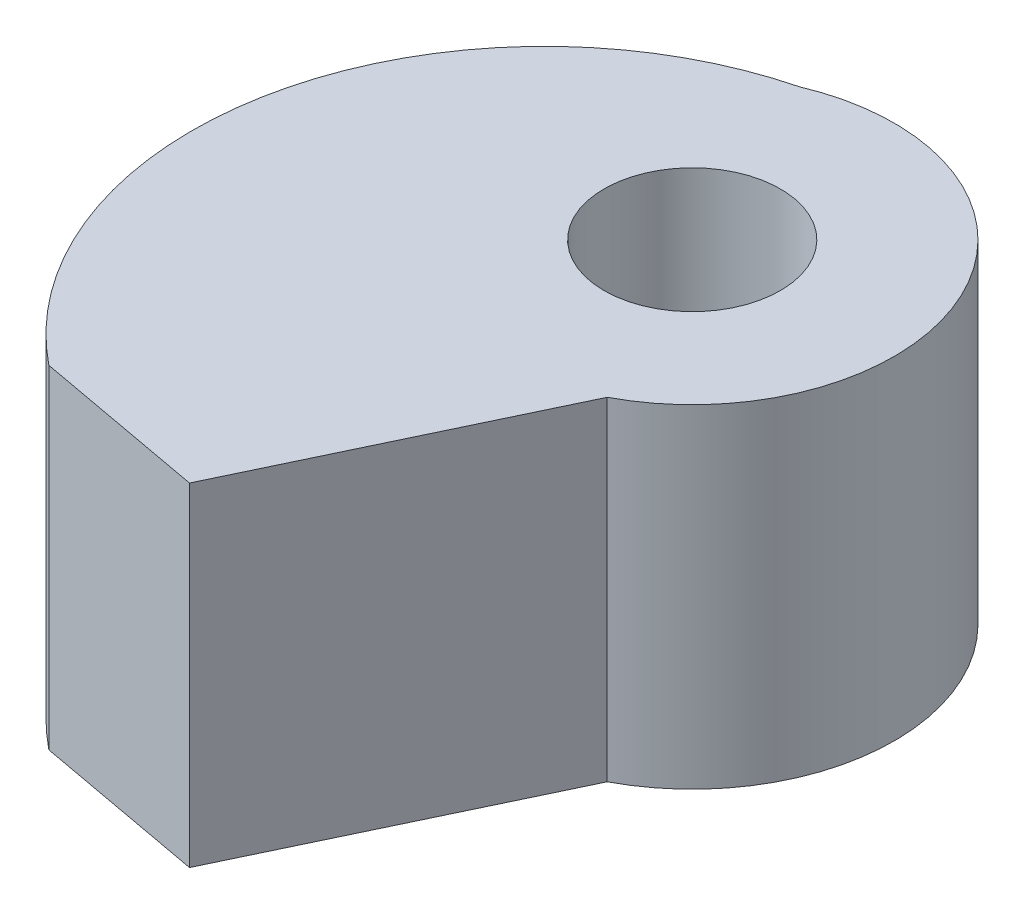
SolidWorks part; units mm, degrees
ref_plane "Plan de face" through (0, 0, 0) normal (0, 0, 1) x (1, 0, 0)
ref_plane "Plan de dessus" through (0, 0, 0) normal (0, 1, 0) x (1, 0, 0)
ref_plane "Plan de droite" through (0, 0, 0) normal (1, 0, 0) x (0, 0, -1)
sketch "Esquisse1" plane through (0, 0, 0) normal (0, 1, 0) x (1, 0, 0)
  circle A0 centre (0, 0) radius 2.45
  circle A1 centre (0, 0) radius 5.158
  dimension "D1" = 4.9
extrude "Boss.-Extru.1" add sketch "Esquisse1" along normal blind 2.5
sketch "Esquisse2" plane through (0, 2.5, 0) normal (0, 1, 0) x (1, 0, 0)
  circle A0 centre (0, 0) radius 5.158
  circle A1 centre (0, 0) radius 1
  dimension "D1" = 2
extrude "Boss.-Extru.2" add sketch "Esquisse2" along normal blind 6
sketch "Esquisse3" plane through (0, 8.5, 0) normal (0, 1, 0) x (1, 0, 0)
  circle A0 centre (0, 0) radius 2.25
  dimension "D1" = 4.5
extrude "Enlèv. mat.-Extru.1" cut sketch "Esquisse3" against normal blind 5.5
sketch "Esquisse4" plane through (0, 8.5, 0) normal (0, 1, 0) x (1, 0, 0)
  line L5 (-1.0378, -11.7939) -> (2.3976, -4.5669)
  line L6 (2.3976, -4.5669) -> (-3.1636, -1.8909)
  line L7 (-3.1636, -1.8909) -> (-2.8226, 2.5391)
  line L8 (-2.8226, 2.5391) -> (1.5082, 4.9326)
  line L9 (-5.4353, -10.9867) -> (-1.0378, -11.7939)
  arc A2 (1.5082, 4.9326) -> (-5.4353, -10.9867) centre (0.2038, -3.9724) ccw
  circle A4 centre (0, 0) radius 5.158 construction
  dimension "D2" = 9
extrude "Boss.-Extru.3" add sketch "Esquisse4" against normal blind 8.5
